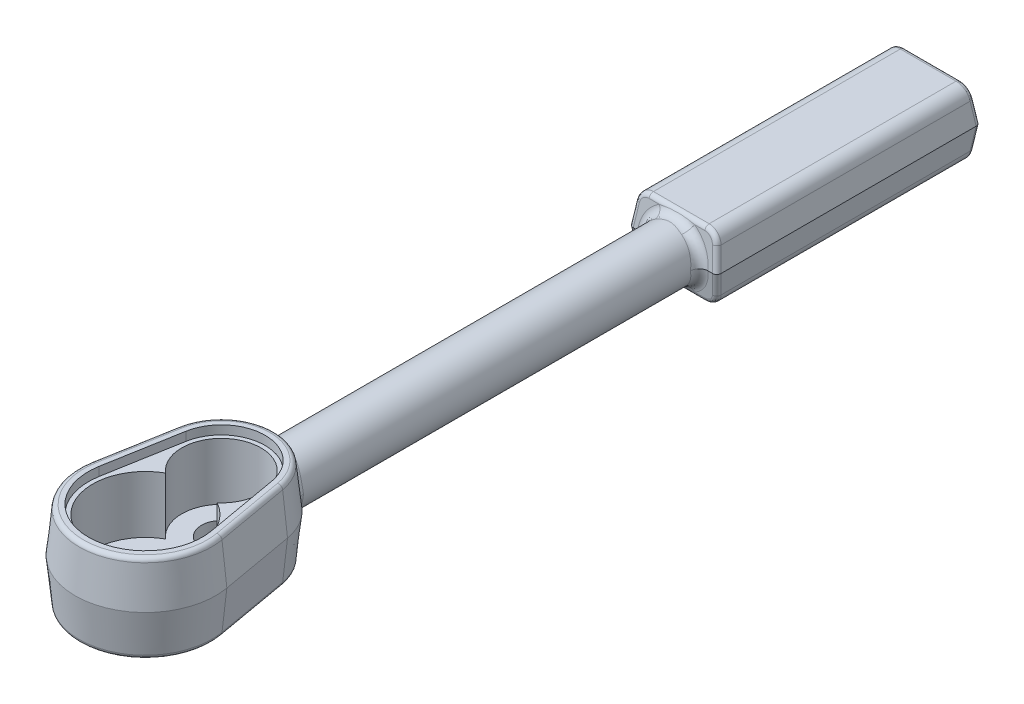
SolidWorks part; units mm, degrees
ref_plane "Front Plane" through (0, 0, 0) normal (0, 0, 1) x (1, 0, 0)
ref_plane "Top Plane" through (0, 0, 0) normal (0, 1, 0) x (1, 0, 0)
ref_plane "Right Plane" through (0, 0, 0) normal (1, 0, 0) x (0, 0, -1)
sketch "Sketch1" plane through (0, 0, 0) normal (0, 1, 0) x (1, 0, 0)
  line L0 (0, 0) -> (0, 180) construction
  line L1 (-10, 180) -> (10, 180)
  line L2 (10, 180) -> (10, 120)
  line L3 (-10, 180) -> (-10, 120)
  line L4 (10, 120) -> (0, 120)
  line L5 (-10, 120) -> (0, 120)
  dimension "D1" = 10
  dimension "D2" = 120
  dimension "Length" = 180
extrude "Handle" add sketch "Sketch1" along normal mid plane 15 draft 8
sketch "Sketch2" plane through (0, 0, 0) normal (0, 0, 1) x (1, 0, 0)
  circle A0 centre (0, 0) radius 6
  dimension "D1" = 12
extrude "Transition" add sketch "Sketch2" against normal up to next
sketch "Sketch3" plane through (0, 0, 0) normal (0, 1, 0) x (1, 0, 0)
  line L0 (0, 0) -> (0, 17.2763) construction
  line L1 (-12.8025, 19.5337) -> (-15.7569, 2.7784)
  line L2 (12.8025, 19.5337) -> (15.7569, 2.7784)
  arc A0 (15.7569, 2.7784) -> (-15.7569, 2.7784) centre (0, 0) cw
  arc A1 (-12.8025, 19.5337) -> (12.8025, 19.5337) centre (0, 17.2763) cw
  point P6 (-83.0935, 90.1057)
  point P8 (-86.6918, 73.3136)
  dimension "D1" = 13
  dimension "D2" = 16
  dimension "D4" = 20
extrude "Head" add sketch "Sketch3" along normal mid plane 20 draft 6
sketch "Sketch4" plane through (0, 10, 0) normal (0, 1, 0) x (-1, 0, 0)
  line L4 (9.7978, -19.0039) -> (12.7522, -2.2486)
  line L5 (-12.7522, -2.2486) -> (-9.7978, -19.0039)
  line L6 (9.7978, -19.0039) -> (12.7522, -2.2486)
  line L7 (-12.7522, -2.2486) -> (-9.7978, -19.0039)
  arc A4 (-9.7978, -19.0039) -> (9.7978, -19.0039) centre (0, -17.2763) ccw
  arc A5 (12.7522, -2.2486) -> (-12.7522, -2.2486) centre (0, 0) ccw
  arc A6 (-9.7978, -19.0039) -> (9.7978, -19.0039) centre (0, -17.2763) ccw
  arc A7 (12.7522, -2.2486) -> (-12.7522, -2.2486) centre (0, 0) ccw
  dimension "D1" = 2
extrude "Recess" cut sketch "Sketch4" against normal blind 2
sketch "Sketch5" plane through (0, 8, 0) normal (0, 1, 0) x (-1, 0, 0)
  arc A0 (-5.8786, -10.4615) -> (5.8786, -10.4615) centre (0, -17.2763) ccw
  arc A1 (5.8786, -10.4615) -> (-5.8786, -10.4615) centre (0, 0) ccw
  arc A2 (12.7522, -2.2486) -> (-12.7522, -2.2486) centre (0, 0) ccw construction
  dimension "D1" = 18
  dimension "D2" = 24
extrude "Pocket" cut sketch "Sketch5" against normal offset from surface (13 mm away) 5
sketch "Sketch6" plane through (0, -5, 0) normal (0, 1, 0) x (-1, 0, 0)
  circle A0 centre (0, -17.2763) radius 4.5
  dimension "D1" = 9
extrude "Wheel Hole" cut sketch "Sketch6" against normal through all
sketch "Sketch7" plane through (-4.6514, -5, 19.111) normal (0, 1, 0) x (-1, 0, 0)
  circle A0 centre (-4.6514, -19.111) radius 6
  arc A1 (1.2272, -29.5724) -> (-10.53, -29.5724) centre (-4.6514, -19.111) ccw construction
  dimension "D1" = 6
extrude "Ratchet Hole" cut sketch "Sketch7" against normal through all
fillet "Handle Fillets" radius 3 4 edges at (8.9459, 7.5, -150) (-8.9459, -7.5, -150) (8.9459, -7.5, -150) (-8.9459, 7.5, -150)
fillet "H End Fillets" radius 1 28 edges at (-8.3063, 6.7641, -120.9506) (8.3063, 6.7641, -120.9506) (0, 10, -29.2253) (-13.2446, 10, -10.9735) (0, 10, 14.949) (13.2446, 10, -10.9735) (0, -10, -29.2253) (13.2446, -10, -10.9735) (0, -10, 14.949) (-13.2446, -10, -10.9735) (-9.6544, -2.4588, -179.6544) (-9.6544, -2.4588, -120.3456) (0, -7.5, -121.0541) (9.6544, -2.4588, -120.3456) (8.3063, -6.7641, -120.9506) (-8.3063, -6.7641, -120.9506) (0, -7.5, -178.9459) (9.6544, -2.4588, -179.6544) (8.3063, -6.7641, -179.0494) (-8.3063, -6.7641, -179.0494) (0, 7.5, -121.0541) (0, 7.5, -178.9459) (-9.6544, 2.4588, -179.6544) (9.6544, 2.4588, -179.6544) (-8.3063, 6.7641, -179.0494) (8.3063, 6.7641, -179.0494) (9.6544, 2.4588, -120.3456) (-9.6544, 2.4588, -120.3456)
fillet "T-H Fillets" radius 2 4 edges at (0.2191, 5.996, -29.6442) (0.2191, -5.996, -29.6442) (0, 6, -120.8432) (0, -6, -120.8432)
